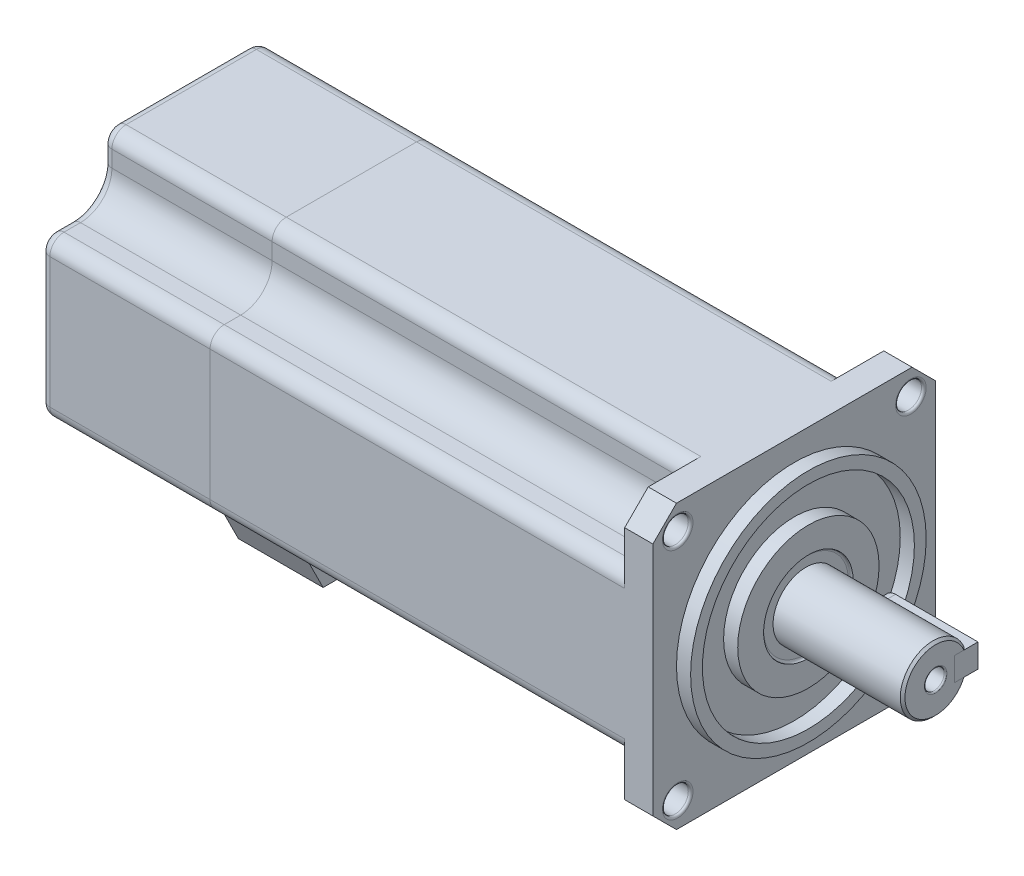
SolidWorks part; units mm, degrees
ref_plane "前视基准面" through (0, 0, 0) normal (0, 0, 1) x (1, 0, 0)
ref_plane "上视基准面" through (0, 0, 0) normal (0, 1, 0) x (1, 0, 0)
ref_plane "右视基准面" through (0, 0, 0) normal (1, 0, 0) x (0, 0, -1)
sketch "草图1" plane through (0, 0, 0) normal (1, 0, 0) x (0, 0, -1)
  line L0 (-30, 25) -> (-25, 30)
  line L1 (-25, -30) -> (25, -30)
  line L2 (-30, -25) -> (-30, 25)
  line L3 (-25, 30) -> (25, 30)
  line L4 (30, -25) -> (30, 25)
  line L5 (-30, -30) -> (30, 30) construction
  line L6 (-30, 30) -> (30, -30) construction
  line L7 (25, 30) -> (30, 25)
  line L8 (25, -30) -> (30, -25)
  line L9 (-30, -25) -> (-25, -30)
  point P0 (0, 0)
extrude "凸台-拉伸2" add sketch "草图1" against normal blind 94
sketch "草图2" plane through (-94, 0, 0) normal (-1, 0, 0) x (0, 0, 1)
  line L0 (-23.5, 16.8292) -> (-27, 16.8292)
  line L1 (-30, -25) -> (-30, 25) construction
  line L2 (-30, 13.8292) -> (-30, -13.8292)
  line L3 (-23.5, -16.8292) -> (-27, -16.8292)
  line L4 (-25, 30) -> (-30, 25)
  line L5 (-16.8292, -23.5) -> (-16.8292, -27)
  line L6 (25, -30) -> (-25, -30) construction
  line L7 (-13.8292, -30) -> (13.8292, -30)
  line L8 (30, -13.8292) -> (30, 13.8292)
  line L9 (16.8292, -23.5) -> (16.8292, -27)
  line L11 (-30, -25) -> (-30, -13.8292)
  line L12 (23.5, -16.8292) -> (27, -16.8292)
  line L13 (30, 25) -> (30, -25) construction
  line L14 (-30, -25) -> (-25, -30)
  line L15 (23.5, 16.8292) -> (27, 16.8292)
  line L16 (-25, -30) -> (-13.8292, -30)
  line L17 (16.8292, 23.5) -> (16.8292, 27)
  line L18 (-25, 30) -> (25, 30) construction
  line L19 (-13.8292, -30) -> (-13.8107, -29.8429)
  line L20 (13.8292, -30) -> (25, -30)
  line L21 (-16.8292, 23.5) -> (-16.8292, 27)
  line L22 (25, -30) -> (30, -25)
  line L23 (30, -25) -> (30, -13.8292)
  line L24 (30, 13.8292) -> (30, 25)
  line L25 (30, 25) -> (25, 30)
  line L26 (25, 30) -> (13.8292, 30)
  line L27 (-13.8292, 30) -> (-25, 30)
  line L28 (-30, 25) -> (-30, 13.8292)
  arc A0 (-23.5, 16.8292) -> (-16.8292, 23.5) centre (-23.5, 23.5) ccw
  arc A1 (16.8292, 23.5) -> (23.5, 16.8292) centre (23.5, 23.5) ccw
  arc A2 (23.5, -16.8292) -> (16.8292, -23.5) centre (23.5, -23.5) ccw
  arc A3 (-16.8292, -23.5) -> (-23.5, -16.8292) centre (-23.5, -23.5) ccw
  arc A4 (-27, 16.8292) -> (-30, 13.8292) centre (-27, 13.8292) ccw
  arc A5 (-27, -16.8292) -> (-30, -13.8292) centre (-27, -13.8292) cw
  arc A6 (-16.8292, -27) -> (-13.8292, -30) centre (-13.8292, -27) ccw
  arc A7 (16.8292, -27) -> (13.8292, -30) centre (13.8292, -27) cw
  arc A8 (27, -16.8292) -> (30, -13.8292) centre (27, -13.8292) ccw
  arc A9 (27, 16.8292) -> (30, 13.8292) centre (27, 13.8292) cw
  arc A10 (16.8292, 27) -> (13.8292, 30) centre (13.8292, 27) ccw
  arc A11 (-16.8292, 27) -> (-13.8292, 30) centre (-13.8292, 27) cw
  point P36 (-30, 16.8292)
  point P39 (-30, -16.8292)
  point P42 (-16.8292, -30)
  point P52 (16.8292, -30)
  point P55 (30, -16.8292)
  point P58 (30, 16.8292)
  point P61 (16.8292, 30)
  point P64 (-16.8292, 30)
  dimension "D1" = 3
extrude "切除-拉伸2" cut sketch "草图2" against normal blind 88 contours L21 A11 A4 L0 A0 M3 M4 M5 | A10 L17 A1 L15 A9 M1 M2 M3 | A8 L12 A2 L9 A7 M7 M8 M1 | A6 L5 A3 L3 A5 M5 M6 M7
sketch "草图4" plane through (0, 0, 0) normal (1, 0, 0) x (0, 0, -1)
  circle A1 centre (-24.7487, 24.7487) radius 2.75
  circle A2 centre (24.7487, 24.7487) radius 2.75
  circle A3 centre (24.7487, -24.7487) radius 2.75
  circle A4 centre (-24.7487, -24.7487) radius 2.75
extrude "切除-拉伸3" cut sketch "草图4" against normal blind 6
sketch "草图5" plane through (0, 0, 0) normal (1, 0, 0) x (0, 0, -1)
  circle A0 centre (0, 0) radius 25
  circle A1 centre (0, 0) radius 22.5
extrude "凸台-拉伸3" add sketch "草图5" along normal blind 3
sketch "草图6" plane through (0, 0, 0) normal (1, 0, 0) x (0, 0, -1)
  circle A0 centre (0, 0) radius 15
extrude "凸台-拉伸4" add sketch "草图6" along normal blind 3
sketch "草图7" plane through (3, 0, 0) normal (1, 0, 0) x (0, 0, -1)
  circle A0 centre (0, 0) radius 9.5
extrude "切除-拉伸4" cut sketch "草图7" against normal blind 0.5
fillet "圆角1" radius 0.5 1 edges at (2.5, 0, -9.5)
sketch "草图8" plane through (2.5, 0, 0) normal (1, 0, 0) x (0, 0, -1)
  circle A0 centre (0, 0) radius 7
extrude "凸台-拉伸5" add sketch "草图8" along normal blind 27.5
ref_plane "基准面1" through (0, 0, -7) normal (0, 0, 1) x (1, 0, 0)
sketch "草图10" plane through (0, 0, -7) normal (0, 0, 1) x (1, 0, 0)
  line L1 (30, -7) -> (30, 7) construction
  line L2 (12.5, -2.5) -> (30, -2.5)
  line L3 (30, -2.5) -> (30, 2.5)
  line L4 (30, 2.5) -> (12.5, 2.5)
  arc A0 (12.5, 2.5) -> (12.5, -2.5) centre (12.5, 0) ccw
extrude "切除-拉伸6" cut sketch "草图10" along normal blind 3
sketch "草图11" plane through (0, 0, -4) normal (0, 0, -1) x (-1, 0, 0)
  line L0 (-12.5, 2.5) -> (-30, 2.5)
  line L1 (-30, 2.5) -> (-30, -2.5)
  line L2 (-30, -2.5) -> (-12.5, -2.5)
  arc A0 (-12.5, -2.5) -> (-12.5, 2.5) centre (-12.5, 0) ccw
extrude "凸台-拉伸6" add sketch "草图11" along normal blind 5 separate body
chamfer "倒角1" distance 0.5 angle 45 1 edges at (30, 0, 7)
sketch "草图12" plane through (-94, 0, 0) normal (-1, 0, 0) x (0, 0, 1)
  line L0 (-23.5, 16.8292) -> (-27, 16.8292)
  line L1 (-30, 25) -> (-30, 13.8292) construction
  line L2 (-30, -13.8292) -> (-30, 13.8292)
  line L3 (-23.5, -16.8292) -> (-27, -16.8292)
  line L4 (-30, -13.8292) -> (-30, -25) construction
  line L5 (-13.8292, 30) -> (13.8292, 30)
  line L6 (-16.8292, -23.5) -> (-16.8292, -27)
  line L7 (-25, -30) -> (-13.8292, -30) construction
  line L8 (30, 13.8292) -> (30, -13.8292)
  line L9 (16.8292, -23.5) -> (16.8292, -27)
  line L10 (13.8292, -30) -> (25, -30) construction
  line L11 (13.8292, -30) -> (-13.8292, -30)
  line L12 (23.5, -16.8292) -> (27, -16.8292)
  line L13 (30, -25) -> (30, -13.8292) construction
  line L15 (23.5, 16.8292) -> (27, 16.8292)
  line L16 (30, 13.8292) -> (30, 25) construction
  line L18 (16.8292, 23.5) -> (16.8292, 27)
  line L19 (25, 30) -> (13.8292, 30) construction
  line L21 (-16.8292, 23.5) -> (-16.8292, 27)
  line L22 (-13.8292, 30) -> (-25, 30) construction
  arc A0 (-16.8292, -23.5) -> (-23.5, -16.8292) centre (-23.5, -23.5) ccw
  arc A1 (23.5, -16.8292) -> (16.8292, -23.5) centre (23.5, -23.5) ccw
  arc A2 (16.8292, 23.5) -> (23.5, 16.8292) centre (23.5, 23.5) ccw
  arc A3 (-23.5, 16.8292) -> (-16.8292, 23.5) centre (-23.5, 23.5) ccw
  arc A4 (-27, -16.8292) -> (-30, -13.8292) centre (-27, -13.8292) cw
  arc A5 (-16.8292, -27) -> (-13.8292, -30) centre (-13.8292, -27) ccw
  arc A6 (16.8292, -27) -> (13.8292, -30) centre (13.8292, -27) cw
  arc A7 (27, -16.8292) -> (30, -13.8292) centre (27, -13.8292) ccw
  arc A8 (27, 16.8292) -> (30, 13.8292) centre (27, 13.8292) cw
  arc A9 (16.8292, 27) -> (13.8292, 30) centre (13.8292, 27) ccw
  arc A10 (-16.8292, 27) -> (-13.8292, 30) centre (-13.8292, 27) cw
  arc A11 (-27, 16.8292) -> (-30, 13.8292) centre (-27, 13.8292) ccw
  point P5 (-30, -16.8292)
  point P20 (-16.8292, -30)
  point P53 (16.8292, -30)
  point P56 (30, -16.8292)
  point P59 (30, 16.8292)
  point P62 (16.8292, 30)
  point P65 (-16.8292, 30)
  point P68 (-30, 16.8292)
  dimension "D1" = 3
extrude "凸台-拉伸8" add sketch "草图12" along normal blind 36 separate body
fillet "圆角2" radius 2 24 edges at (-130, 18.783, -18.783) (-130, 15.9505, -29.1213) (-130, 29.1213, -15.9505) (-130, -15.9505, -29.1213) (-130, -18.783, -18.783) (-130, 29.1213, 15.9505) (-130, -29.1213, -15.9505) (-130, 18.783, 18.783) (-130, 15.9505, 29.1213) (-130, -29.1213, 15.9505) (-130, -18.783, 18.783) (-130, -15.9505, 29.1213) (-130, 0, -30) (-130, 30, 0) (-130, 0, 30) (-130, -30, 0) (-130, 16.8292, -25.25) (-130, 25.25, -16.8292) (-130, 25.25, 16.8292) (-130, 16.8292, 25.25) (-130, -16.8292, 25.25) (-130, -25.25, 16.8292) (-130, -25.25, -16.8292) (-130, -16.8292, -25.25)
hole_wizard "M5 螺纹孔1" positions "草图14" profile "草图13" tap size "M5" standard "GB"
sketch "草图14" plane through (30, 0, 0) normal (1, 0, 0) x (0, 0, -1)
  point P0 (0, 0)
sketch "草图13" plane through (30, 0, 0) normal (0, 1, 0) x (0, 0, -1)
  line L0 (0, 0) -> (0, 9.2618)
  line L1 (0, 9.2618) -> (2.1, 8)
  line L2 (2.1, 8) -> (2.1, 0)
  line L5 (2.1, 0) -> (0, 0)
  line L10 (0, 9.2618) -> (-2.1, 8) construction
  line L11 (0, -6.35) -> (0, 107.95) construction
  dimension "螺纹孔钻头直径" = 4.2
  dimension "螺纹孔钻头深度" = 8
  dimension "导头角度" = 118
sketch "草图19" plane through (0, -30, 0) normal (0, -1, 0) x (-1, 0, 0)
  line L3 (112, 12) -> (94, 12)
  line L4 (112, 12) -> (112, -12)
  line L5 (112, -12) -> (94, -12)
  line L6 (94, 12) -> (94, -12)
  line L7 (112, 12) -> (94, -12) construction
  line L8 (112, -12) -> (94, 12) construction
extrude "凸台-拉伸10" add sketch "草图19" along normal blind 12 separate body
sketch "草图20" plane through (-94, 0, 0) normal (1, 0, 0) x (0, 0, -1)
  line L0 (-12, -30) -> (-12, -42)
  line L1 (-12, -42) -> (-6, -42)
  line L2 (12, -42) -> (-12, -42) construction
  line L3 (12, -30) -> (12, -42)
  line L4 (12, -42) -> (6, -42)
  line L5 (-12, -30) -> (-6, -42)
  line L6 (6, -42) -> (12, -30)
extrude "切除-拉伸7" cut sketch "草图20" against normal blind 18
fillet "圆角3" radius 0.5 4 edges at (0, 24.7487, -27.4987) (0, -24.7487, -27.4987) (0, -24.7487, 21.9987) (0, 24.7487, 21.9987)
fillet "圆角4" radius 0.3 1 edges at (30, 0, -2.1)
